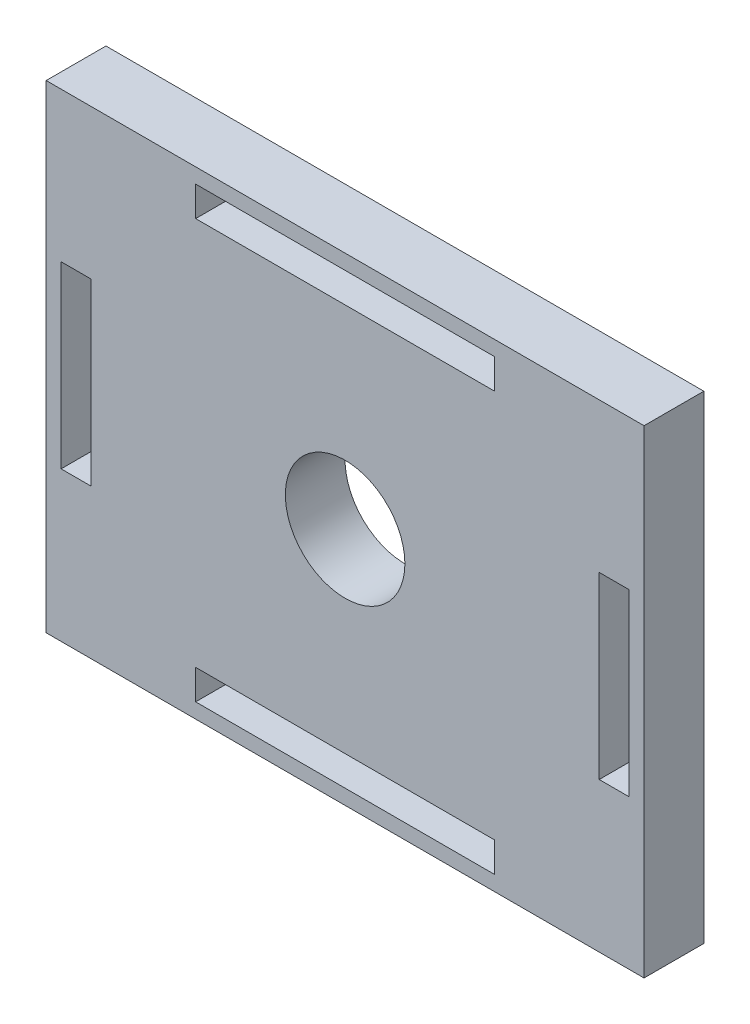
SolidWorks part; units mm, degrees
ref_plane "Front Plane" through (0, 0, 0) normal (0, 0, 1) x (1, 0, 0)
ref_plane "Top Plane" through (0, 0, 0) normal (0, 1, 0) x (1, 0, 0)
ref_plane "Right Plane" through (0, 0, 0) normal (1, 0, 0) x (0, 0, -1)
sketch "Sketch1" plane through (0, 0, 0) normal (0, 0, 1) x (1, 0, 0)
  line L0 (0, 46.4798) -> (0, -62.9283) construction
  line L1 (-50, -40) -> (50, -40)
  line L2 (-50, -40) -> (-50, 40)
  line L3 (-50, 40) -> (50, 40)
  line L4 (50, -40) -> (50, 40)
  line L5 (-58.3178, 35) -> (94.2056, 35) construction
  line L6 (-25, -32.5) -> (-25, -37.5)
  line L7 (-62.5545, 0) -> (94.2056, 0) construction
  line L8 (-25, 32.5) -> (25, 32.5)
  line L9 (-25, 32.5) -> (-25, 37.5)
  line L10 (-25, 37.5) -> (25, 37.5)
  line L11 (25, 32.5) -> (25, 37.5)
  line L12 (-25, 32.5) -> (25, 37.5) construction
  line L13 (-25, 37.5) -> (25, 32.5) construction
  line L14 (25, -32.5) -> (25, -37.5)
  line L15 (-25, -37.5) -> (25, -37.5)
  line L16 (-25, -32.5) -> (25, -32.5)
  line L17 (-45, 46.4798) -> (-45, -60.1869) construction
  line L18 (47.5, 15) -> (42.5, 15)
  line L19 (-47.5, -15) -> (-42.5, -15)
  line L20 (-47.5, -15) -> (-47.5, 15)
  line L21 (-47.5, 15) -> (-42.5, 15)
  line L22 (-42.5, -15) -> (-42.5, 15)
  line L23 (-47.5, -15) -> (-42.5, 15) construction
  line L24 (-47.5, 15) -> (-42.5, -15) construction
  line L25 (45, 46.4798) -> (45, -60.1869) construction
  line L26 (47.5, -15) -> (42.5, -15)
  line L27 (47.5, -15) -> (47.5, 15)
  line L28 (42.5, -15) -> (42.5, 15)
  circle A0 centre (0, 0) radius 10
  point P0 (0, 0)
  point P12 (0, 35)
  point P25 (-45, 0)
  dimension "D6" = 20
  dimension "D1" = 80
  dimension "D2" = 100
  dimension "D3" = 35
  dimension "D4" = 5
  dimension "D5" = 50
  dimension "D7" = 30
  dimension "D8" = 45
  dimension "D9" = 5
extrude "Boss-Extrude1" add sketch "Sketch1" along normal blind 10
